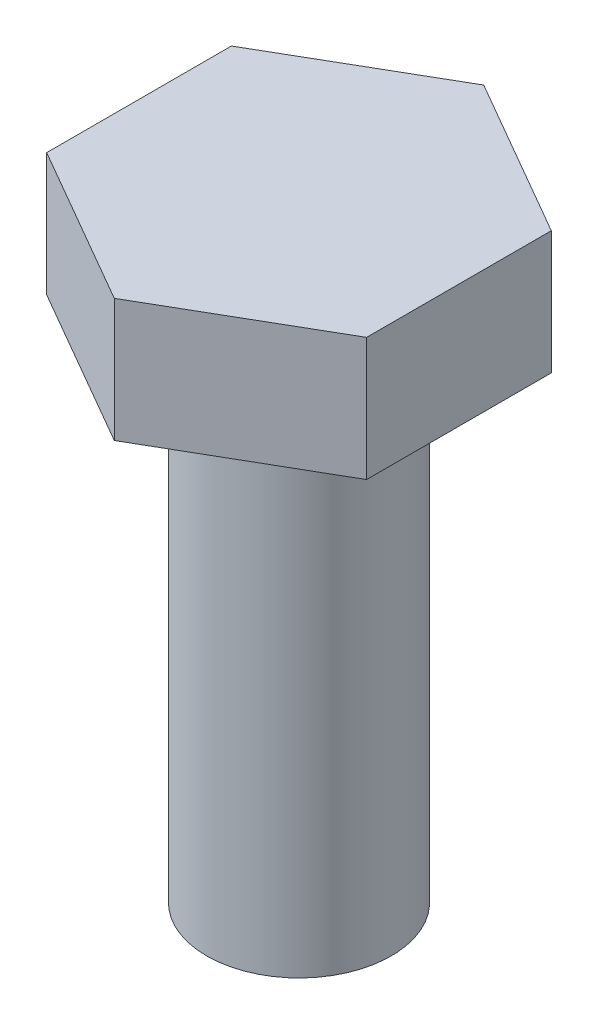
SolidWorks part; units mm, degrees
ref_plane "Front Plane" through (0, 0, 0) normal (0, 0, 1) x (1, 0, 0)
ref_plane "Top Plane" through (0, 0, 0) normal (0, 1, 0) x (1, 0, 0)
ref_plane "Right Plane" through (0, 0, 0) normal (1, 0, 0) x (0, 0, -1)
sketch "Sketch1" plane through (0, 0, 0) normal (0, 1, 0) x (1, 0, 0)
  circle A0 centre (0, 0) radius 7.5
  dimension "D1" = 15
extrude "Extrude1" add sketch "Sketch1" along normal blind 40
sketch "Sketch2" plane through (0, 40, 0) normal (0, 1, 0) x (1, 0, 0)
  line L0 (0, 0) -> (10.3923, 0) construction
  line L1 (12.9904, 7.5) -> (0, 15)
  line L2 (0, 15) -> (-12.9904, 7.5)
  line L3 (-12.9904, 7.5) -> (-12.9904, -7.5)
  line L4 (-12.9904, -7.5) -> (0, -15)
  line L5 (0, -15) -> (12.9904, -7.5)
  line L6 (12.9904, -7.5) -> (12.9904, 7.5)
  circle A0 centre (0, 0) radius 12.9904 construction
  point P10 (-34.5206, 5.5064)
  dimension "D1" = 30
extrude "Extrude2" add sketch "Sketch2" along normal blind 10
